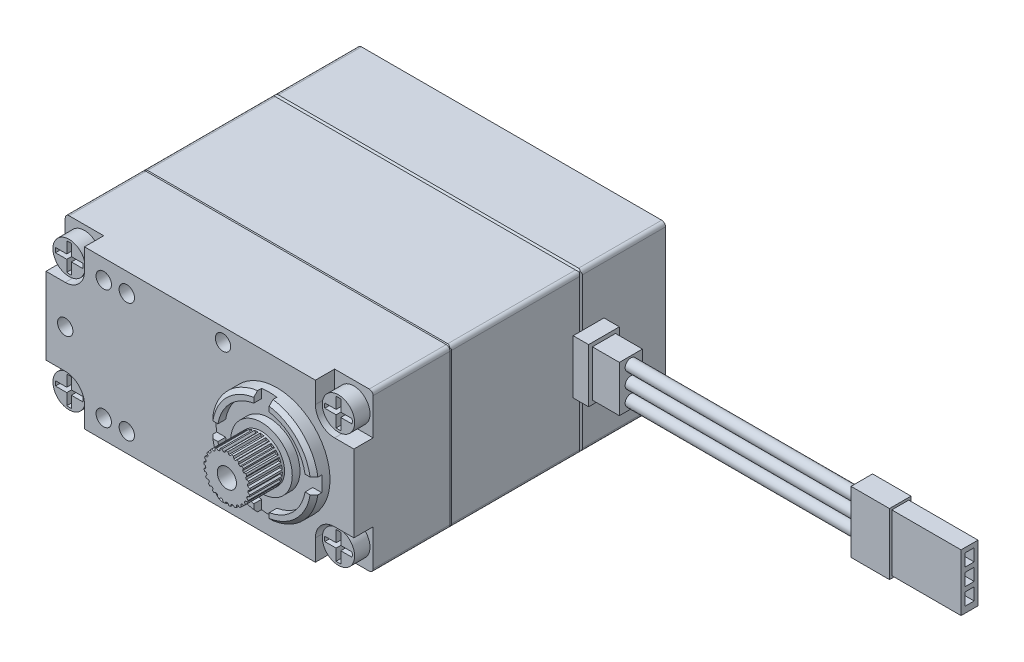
SolidWorks part; units mm, degrees
ref_plane "前视基准面" through (0, 0, 0) normal (0, 0, 1) x (1, 0, 0)
ref_plane "上视基准面" through (0, 0, 0) normal (0, 1, 0) x (1, 0, 0)
ref_plane "右视基准面" through (0, 0, 0) normal (1, 0, 0) x (0, 0, -1)
sketch "草图1" plane through (0, 0, 0) normal (0, 0, 1) x (1, 0, 0)
  line L1 (-20, 10.25) -> (20, 10.25)
  line L2 (-20, 10.25) -> (-20, -10.25)
  line L3 (-20, -10.25) -> (20, -10.25)
  line L4 (20, 10.25) -> (20, -10.25)
  dimension "D1" = 10.25
  dimension "D2" = 20.5
  dimension "D3" = 20
  dimension "D4" = 40
extrude "凸台-拉伸1" add sketch "草图1" along normal blind 11
chamfer "倒角1" distance 0.2 angle 45 4 edges at (0, 10.25, 11) (20, 0, 11) (0, -10.25, 11) (-20, 0, 11)
sketch "草图2" plane through (0, 0, 11) normal (0, 0, 1) x (1, 0, 0)
  line L0 (20, 10.25) -> (20, -10.25) construction
  line L1 (20, -10.25) -> (-20, -10.25) construction
  line L2 (-20, -10.25) -> (-20, 10.25) construction
  line L3 (-20, 10.25) -> (20, 10.25) construction
  line L4 (20, 10.25) -> (20, -10.25)
  line L5 (20, -10.25) -> (-20, -10.25)
  line L6 (-20, -10.25) -> (-20, 10.25)
  line L7 (-20, 10.25) -> (20, 10.25)
extrude "凸台-拉伸2" add sketch "草图2" along normal blind 17
chamfer "倒角4" distance 0.2 angle 45 4 edges at (-20, 0, 11) (0, 10.25, 11) (20, 0, 11) (0, -10.25, 11)
chamfer "倒角5" distance 0.2 angle 45 4 edges at (20, 0, 28) (0, -10.25, 28) (-20, 0, 28) (0, 10.25, 28)
sketch "草图3" plane through (0, 0, 28) normal (0, 0, 1) x (1, 0, 0)
  line L0 (20, 10.25) -> (20, -10.25) construction
  line L1 (20, -10.25) -> (-20, -10.25) construction
  line L2 (-20, -10.25) -> (-20, 10.25) construction
  line L3 (-20, 10.25) -> (20, 10.25) construction
  line L4 (20, 10.25) -> (20, -10.25)
  line L5 (20, -10.25) -> (-20, -10.25)
  line L6 (-20, -10.25) -> (-20, 10.25)
  line L7 (-20, 10.25) -> (20, 10.25)
extrude "凸台-拉伸3" add sketch "草图3" along normal blind 12.5
sketch "草图4" plane through (0, 0, 40.5) normal (0, 0, 1) x (1, 0, 0)
  line L0 (20, -10.25) -> (20, 10.25) construction
  circle A0 centre (10, 0) radius 6.9
  dimension "D1" = 10
  dimension "D2" = 13.8
extrude "凸台-拉伸4" add sketch "草图4" along normal blind 2
sketch "草图5" plane through (0, 0, 42.5) normal (0, 0, 1) x (1, 0, 0)
  circle A0 centre (10, 0) radius 3
  dimension "D1" = 6
extrude "凸台-拉伸5" add sketch "草图5" along normal blind 4.5
sketch "草图6" plane through (0, 0, 42.5) normal (0, 0, 1) x (1, 0, 0)
  circle A0 centre (10, 0) radius 4
  circle A1 centre (10, 0) radius 5.75
  dimension "D1" = 8
  dimension "D2" = 11.5
extrude "切除-拉伸1" cut sketch "草图6" against normal blind 1
sketch "草图7" plane through (0, 0, 41.5) normal (0, 0, 1) x (1, 0, 0)
  line L0 (11, 6.8272) -> (11, 5.6624)
  line L1 (3.1728, -1) -> (4.3376, -1)
  line L2 (3.1728, 1) -> (4.3376, 1)
  line L5 (9, 6.8272) -> (9, 5.6624)
  line L6 (16.8272, -1) -> (15.6624, -1)
  line L7 (16.8272, 1) -> (15.6624, 1)
  line L8 (9, -6.8272) -> (9, -5.6624)
  line L9 (11, -6.8272) -> (11, -5.6624)
  circle A0 centre (10, 0) radius 5.75 construction
  arc A1 (4.3376, 1) -> (4.3376, -1) centre (10, 0) ccw
  circle A2 centre (10, 0) radius 6.9 construction
  arc A3 (3.1728, 1) -> (3.1728, -1) centre (10, 0) ccw
  arc A6 (11, 5.6624) -> (9, 5.6624) centre (10, 0) ccw
  arc A7 (11, 6.8272) -> (9, 6.8272) centre (10, 0) ccw
  arc A8 (15.6624, -1) -> (15.6624, 1) centre (10, 0) ccw
  arc A9 (16.8272, -1) -> (16.8272, 1) centre (10, 0) ccw
  arc A10 (9, -5.6624) -> (11, -5.6624) centre (10, 0) ccw
  arc A11 (9, -6.8272) -> (11, -6.8272) centre (10, 0) ccw
  point P3 (0.7328, -1)
  point P4 (20.4054, -1)
  point P5 (0.7328, 1)
  point P6 (20.4054, 1)
  point P27 (10, 0)
  dimension "D1" = 4
extrude "切除-拉伸5" cut sketch "草图7" along normal blind 1
ref_plane "基准面1" through (0, 0, 27.7) normal (0, 0, 1) x (1, 0, 0)
sketch "草图11" plane through (0, 0, 47) normal (0, 0, 1) x (1, 0, 0)
  circle A0 centre (10, 0) radius 1.25
  dimension "D1" = 2.5
extrude "切除-拉伸7" cut sketch "草图11" against normal blind 6
sketch "草图12" plane through (0, 0, 47) normal (0, 0, 1) x (1, 0, 0)
  line L1 (9.76, 2.7395) -> (9.88, 2.9976)
  line L2 (10.24, 2.7395) -> (10.12, 2.9976)
  line L3 (10.9137, 2.5938) -> (10.8617, 2.8736)
  line L4 (10.4488, 2.7131) -> (10.6292, 2.9333)
  line L5 (11.5301, 2.285) -> (11.5493, 2.569)
  line L6 (11.1095, 2.5163) -> (11.3389, 2.6846)
  line L7 (12.0503, 1.8327) -> (12.1395, 2.103)
  line L8 (11.7004, 2.1613) -> (11.9645, 2.2673)
  line L9 (12.4416, 1.2653) -> (12.5953, 1.5049)
  line L10 (12.1844, 1.6705) -> (12.4667, 1.7075)
  line L11 (12.6796, 0.6183) -> (12.888, 0.8122)
  line L12 (12.5313, 1.0748) -> (12.8138, 1.0404)
  line L13 (12.7492, -0.0675) -> (12.9992, 0.0685)
  line L14 (12.719, 0.4115) -> (12.9841, 0.308)
  line L15 (12.646, -0.7491) -> (12.922, -0.6796)
  line L16 (12.736, -0.2776) -> (12.967, -0.4438)
  line L17 (12.3766, -1.3836) -> (12.6612, -1.3849)
  line L18 (12.581, -0.9493) -> (12.7634, -1.1677)
  line L19 (11.9578, -1.9312) -> (12.2332, -2.0032)
  line L20 (12.2638, -1.5613) -> (12.3862, -1.8183)
  line L21 (11.4161, -2.3574) -> (11.6649, -2.4956)
  line L22 (11.8044, -2.0752) -> (11.859, -2.3546)
  line L23 (10.7853, -2.6355) -> (10.9919, -2.8313)
  line L24 (11.2316, -2.4588) -> (11.2151, -2.7429)
  line L25 (10.1052, -2.748) -> (10.2566, -2.989)
  line L26 (10.5815, -2.6878) -> (10.4948, -2.9589)
  line L27 (9.4185, -2.6878) -> (9.5052, -2.9589)
  line L28 (9.8948, -2.748) -> (9.7434, -2.989)
  line L29 (8.7684, -2.4588) -> (8.7849, -2.7429)
  line L30 (9.2147, -2.6355) -> (9.0081, -2.8313)
  line L31 (8.1956, -2.0752) -> (8.141, -2.3546)
  line L32 (8.5839, -2.3574) -> (8.3351, -2.4956)
  line L33 (7.7362, -1.5613) -> (7.6138, -1.8183)
  line L34 (8.0422, -1.9312) -> (7.7668, -2.0032)
  line L35 (7.419, -0.9493) -> (7.2366, -1.1677)
  line L36 (7.6234, -1.3836) -> (7.3388, -1.3849)
  line L37 (7.264, -0.2776) -> (7.033, -0.4438)
  line L38 (7.354, -0.7491) -> (7.078, -0.6796)
  line L39 (7.281, 0.4115) -> (7.0159, 0.308)
  line L40 (7.2508, -0.0675) -> (7.0008, 0.0685)
  line L41 (7.4687, 1.0748) -> (7.1862, 1.0404)
  line L42 (7.3204, 0.6183) -> (7.112, 0.8122)
  line L43 (7.8156, 1.6705) -> (7.5333, 1.7075)
  line L44 (7.5584, 1.2653) -> (7.4047, 1.5049)
  line L45 (8.2996, 2.1613) -> (8.0355, 2.2673)
  line L46 (7.9497, 1.8327) -> (7.8605, 2.103)
  line L47 (8.8905, 2.5163) -> (8.6611, 2.6846)
  line L48 (8.4699, 2.285) -> (8.4507, 2.569)
  line L49 (9.5512, 2.7131) -> (9.3708, 2.9333)
  line L50 (9.0863, 2.5938) -> (9.1383, 2.8736)
  arc A0 (9.76, 2.7395) -> (9.5512, 2.7131) centre (10, 0) ccw
  arc A1 (9.0863, 2.5938) -> (8.8905, 2.5163) centre (10, 0) ccw
  circle A2 centre (10, 0) radius 3 construction
  arc A3 (9.88, 2.9976) -> (9.3708, 2.9333) centre (10, 0) ccw
  arc A4 (9.1383, 2.8736) -> (8.6611, 2.6846) centre (10, 0) ccw
  arc A5 (8.4699, 2.285) -> (8.2996, 2.1613) centre (10, 0) ccw
  arc A6 (8.4507, 2.569) -> (8.0355, 2.2673) centre (10, 0) ccw
  arc A7 (7.9497, 1.8327) -> (7.8156, 1.6705) centre (10, 0) ccw
  arc A8 (7.8605, 2.103) -> (7.5333, 1.7075) centre (10, 0) ccw
  arc A9 (7.5584, 1.2653) -> (7.4687, 1.0748) centre (10, 0) ccw
  arc A10 (7.4047, 1.5049) -> (7.1862, 1.0404) centre (10, 0) ccw
  arc A11 (7.3204, 0.6183) -> (7.281, 0.4115) centre (10, 0) ccw
  arc A12 (7.112, 0.8122) -> (7.0159, 0.308) centre (10, 0) ccw
  arc A13 (7.2508, -0.0675) -> (7.264, -0.2776) centre (10, 0) ccw
  arc A14 (7.0008, 0.0685) -> (7.033, -0.4438) centre (10, 0) ccw
  arc A15 (7.354, -0.7491) -> (7.419, -0.9493) centre (10, 0) ccw
  arc A16 (7.078, -0.6796) -> (7.2366, -1.1677) centre (10, 0) ccw
  arc A17 (7.3388, -1.3849) -> (7.6138, -1.8183) centre (10, 0) ccw
  arc A18 (7.6234, -1.3836) -> (7.7362, -1.5613) centre (10, 0) ccw
  arc A19 (8.0422, -1.9312) -> (8.1956, -2.0752) centre (10, 0) ccw
  arc A20 (7.7668, -2.0032) -> (8.141, -2.3546) centre (10, 0) ccw
  arc A21 (8.5839, -2.3574) -> (8.7684, -2.4588) centre (10, 0) ccw
  arc A22 (8.3351, -2.4956) -> (8.7849, -2.7429) centre (10, 0) ccw
  arc A23 (9.2147, -2.6355) -> (9.4185, -2.6878) centre (10, 0) ccw
  arc A24 (9.0081, -2.8313) -> (9.5052, -2.9589) centre (10, 0) ccw
  arc A25 (9.8948, -2.748) -> (10.1052, -2.748) centre (10, 0) ccw
  arc A26 (9.7434, -2.989) -> (10.2566, -2.989) centre (10, 0) ccw
  arc A27 (10.5815, -2.6878) -> (10.7853, -2.6355) centre (10, 0) ccw
  arc A28 (10.4948, -2.9589) -> (10.9919, -2.8313) centre (10, 0) ccw
  arc A29 (11.2316, -2.4588) -> (11.4161, -2.3574) centre (10, 0) ccw
  arc A30 (11.2151, -2.7429) -> (11.6649, -2.4956) centre (10, 0) ccw
  arc A31 (11.8044, -2.0752) -> (11.9578, -1.9312) centre (10, 0) ccw
  arc A32 (11.859, -2.3546) -> (12.2332, -2.0032) centre (10, 0) ccw
  arc A33 (12.3862, -1.8183) -> (12.6612, -1.3849) centre (10, 0) ccw
  arc A34 (12.2638, -1.5613) -> (12.3766, -1.3836) centre (10, 0) ccw
  arc A35 (12.7634, -1.1677) -> (12.922, -0.6796) centre (10, 0) ccw
  arc A36 (12.581, -0.9493) -> (12.646, -0.7491) centre (10, 0) ccw
  arc A37 (12.967, -0.4438) -> (12.9992, 0.0685) centre (10, 0) ccw
  arc A38 (12.736, -0.2776) -> (12.7492, -0.0675) centre (10, 0) ccw
  arc A39 (12.9841, 0.308) -> (12.888, 0.8122) centre (10, 0) ccw
  arc A40 (12.719, 0.4115) -> (12.6796, 0.6183) centre (10, 0) ccw
  arc A41 (12.5313, 1.0748) -> (12.4416, 1.2653) centre (10, 0) ccw
  arc A42 (12.8138, 1.0404) -> (12.5953, 1.5049) centre (10, 0) ccw
  arc A43 (12.1844, 1.6705) -> (12.0503, 1.8327) centre (10, 0) ccw
  arc A44 (12.4667, 1.7075) -> (12.1395, 2.103) centre (10, 0) ccw
  arc A45 (11.7004, 2.1613) -> (11.5301, 2.285) centre (10, 0) ccw
  arc A46 (11.9645, 2.2673) -> (11.5493, 2.569) centre (10, 0) ccw
  arc A47 (11.1095, 2.5163) -> (10.9137, 2.5938) centre (10, 0) ccw
  arc A48 (11.3389, 2.6846) -> (10.8617, 2.8736) centre (10, 0) ccw
  arc A49 (10.4488, 2.7131) -> (10.24, 2.7395) centre (10, 0) ccw
  arc A50 (10.6292, 2.9333) -> (10.12, 2.9976) centre (10, 0) ccw
  point P111 (10, 0)
  dimension "D1" = 5.5
  dimension "D4" = 25
extrude "切除-拉伸8" cut sketch "草图12" against normal blind 4.2
sketch "草图17" plane through (20, 0, 0) normal (1, 0, 0) x (0, 0, -1)
  line L2 (-12, 3.5) -> (-8, 3.5)
  line L3 (-12, 3.5) -> (-12, -3.5)
  line L4 (-12, -3.5) -> (-8, -3.5)
  line L5 (-8, 3.5) -> (-8, -3.5)
  dimension "D2" = 7
  dimension "D3" = 3.5
  dimension "D4" = 4
extrude "凸台-拉伸8" add sketch "草图17" along normal blind 2
sketch "草图18" plane through (22, 0, 0) normal (1, 0, 0) x (0, 0, -1)
  line L8 (-11.5, 3) -> (-11.5, -3)
  line L9 (-11.5, -3) -> (-8.5, -3)
  line L10 (-8.5, -3) -> (-8.5, 3)
  line L11 (-8.5, 3) -> (-11.5, 3)
  line L12 (-11.5, 3) -> (-11.5, -3)
  line L13 (-11.5, -3) -> (-8.5, -3)
  line L14 (-8.5, -3) -> (-8.5, 3)
  line L15 (-8.5, 3) -> (-11.5, 3)
  dimension "D1" = 0.5
extrude "凸台-拉伸9" add sketch "草图18" along normal blind 3.5
sketch "草图19" plane through (25.5, 0, 0) normal (1, 0, 0) x (0, 0, -1)
  line L0 (-8.5, -3) -> (-8.5, 3) construction
  line L1 (-8.5, -3) -> (-8.5, 3) construction
  line L2 (-8.5, 3) -> (-11.5, 3) construction
  circle A0 centre (-10, 0) radius 0.75
  circle A1 centre (-10, 2) radius 0.75
  circle A2 centre (-10, -2) radius 0.75
  dimension "D1" = 1.5
  dimension "D2" = 1.5
  dimension "D3" = 1.5
  dimension "D4" = 1.5
  dimension "D5" = 1.5
  dimension "D6" = 1.5
  dimension "D7" = 1
  dimension "D8" = 2
  dimension "D9" = 2
extrude "凸台-拉伸10" add sketch "草图19" along normal blind 30
sketch "草图20" plane through (55.5, 0, 0) normal (1, 0, 0) x (0, 0, -1)
  line L1 (-11.4, 4) -> (-8.6, 4)
  line L2 (-11.4, 4) -> (-11.4, -4)
  line L3 (-11.4, -4) -> (-8.6, -4)
  line L4 (-8.6, 4) -> (-8.6, -4)
  circle A0 centre (-10, 2) radius 0.75 construction
  dimension "D1" = 8
  dimension "D2" = 2.8
  dimension "D3" = 1.4
  dimension "D4" = 4
extrude "凸台-拉伸11" add sketch "草图20" along normal blind 5
sketch "草图21" plane through (60.5, 0, 0) normal (1, 0, 0) x (0, 0, -1)
  line L5 (-10.59, 3.1) -> (-9.4, 3.1)
  line L6 (-10.59, 3.1) -> (-10.59, 1.5)
  line L7 (-10.59, 1.5) -> (-9.4, 1.5)
  line L8 (-11.1, 3.7) -> (-11.1, -3.7)
  line L9 (-11.1, -3.7) -> (-8.9, -3.7)
  line L10 (-8.9, -3.7) -> (-8.9, 3.7)
  line L11 (-8.9, 3.7) -> (-11.1, 3.7)
  line L12 (-11.1, 3.7) -> (-11.1, -3.7)
  line L13 (-11.1, -3.7) -> (-8.9, -3.7)
  line L14 (-8.9, -3.7) -> (-8.9, 3.7)
  line L15 (-8.9, 3.7) -> (-11.1, 3.7)
  line L16 (-9.4, 3.1) -> (-9.4, 1.5)
  line L17 (-10.59, 0.9) -> (-9.4, 0.9)
  line L18 (-10.59, 0.9) -> (-10.59, -0.7)
  line L19 (-10.59, -0.7) -> (-9.4, -0.7)
  line L20 (-9.4, 0.9) -> (-9.4, -0.7)
  line L21 (-10.59, -1.3) -> (-9.4, -1.3)
  line L22 (-10.59, -1.3) -> (-10.59, -2.9)
  line L23 (-10.59, -2.9) -> (-9.4, -2.9)
  line L24 (-9.4, -1.3) -> (-9.4, -2.9)
  dimension "D2" = 1.6
  dimension "D3" = 1.6
  dimension "D4" = 1.6
  dimension "D5" = 0.5
  dimension "D6" = 0.5
  dimension "D7" = 0.5
  dimension "D8" = 0.6
  dimension "D9" = 0.6
  dimension "D10" = 0.6
  dimension "D1" = 0.3
extrude "凸台-拉伸12" add sketch "草图21" along normal blind 9
chamfer "倒角6" distance 0.5 angle 45 4 edges at (5.121, 4.879, 42.5) (14.879, 4.879, 42.5) (14.879, -4.879, 42.5) (5.121, -4.879, 42.5)
fillet "圆角6" radius 0.5 4 edges at (20, 10.25, 34.25) (20, -10.25, 34.25) (-20, 10.25, 34.25) (-20, -10.25, 34.25)
fillet "圆角7" radius 0.5 4 edges at (20, -10.25, 19.5) (20, 10.25, 19.5) (-20, 10.25, 19.5) (-20, -10.25, 19.5)
fillet "圆角8" radius 0.5 4 edges at (20, 10.25, 5.4) (-20, 10.25, 5.4) (-20, -10.25, 5.4) (20, -10.25, 5.4)
sketch "草图26" plane through (0, 0, 0) normal (0, 0, -1) x (-1, 0, 0)
  circle A0 centre (-10, 0) radius 6.25
  dimension "D1" = 12.5
extrude "凸台-拉伸15" add sketch "草图26" along normal blind 1.5
sketch "草图27" plane through (0, 0, -1.5) normal (0, 0, -1) x (-1, 0, 0)
  circle A0 centre (-10, 0) radius 3.45
  dimension "D1" = 6.9
extrude "凸台-拉伸16" add sketch "草图27" along normal blind 4.3
sketch "草图28" plane through (0, 0, -5.8) normal (0, 0, -1) x (-1, 0, 0)
  circle A0 centre (-10, 0) radius 3
  circle A1 centre (-10, 0) radius 3.45 construction
  circle A2 centre (-10, 0) radius 3.45
  dimension "D1" = 6
extrude "切除-拉伸15" cut sketch "草图28" against normal blind 4.2
sketch "草图29" plane through (0, 0, -5.8) normal (0, 0, -1) x (-1, 0, 0)
  circle A0 centre (-10, 0) radius 1.25
  dimension "D1" = 2.5
extrude "切除-拉伸16" cut sketch "草图29" against normal blind 5
sketch "草图30" plane through (0, 0, 40.5) normal (0, 0, 1) x (1, 0, 0)
  line L0 (20, -9.75) -> (20, 9.75) construction
  line L1 (-20, 9.75) -> (-20, -9.75) construction
  line L2 (19.5, 10.25) -> (-19.5, 10.25) construction
  circle A0 centre (3, 8.5) radius 1
  circle A1 centre (3, -8.5) radius 1
  circle A2 centre (-17.5, 0) radius 1
  circle A3 centre (-9.5, 7.75) radius 1
  circle A4 centre (-12.5, 7.75) radius 1
  circle A5 centre (-12.5, -7.75) radius 1
  circle A6 centre (-9.5, -7.75) radius 1
  dimension "D1" = 2
  dimension "D2" = 2
  dimension "D3" = 8.5
  dimension "D4" = 8.5
  dimension "D5" = 17
  dimension "D6" = 17
  dimension "D7" = 2
  dimension "D8" = 2.5
  dimension "D9" = 2.5
  dimension "D10" = 2
  dimension "D11" = 2
  dimension "D12" = 3
  dimension "D13" = 5
  dimension "D14" = 5
  dimension "D15" = 3
extrude "切除-拉伸17" cut sketch "草图30" against normal blind 3
sketch "草图32" plane through (0, 0, 40.5) normal (0, 0, 1) x (1, 0, 0)
  line L0 (-15, 7.5) -> (-15, 10.25)
  line L1 (-17.5, 5) -> (-20, 5)
  line L2 (19.5, 10.25) -> (-19.5, 10.25) construction
  line L3 (-15, 10.25) -> (-19.5, 10.25)
  line L4 (-20, 9.75) -> (-20, -9.75) construction
  line L5 (-20, 9.75) -> (-20, 5)
  line L8 (-20, -9.75) -> (-20, -5)
  line L9 (-15, -10.25) -> (-19.5, -10.25)
  line L10 (-17.5, -5) -> (-20, -5)
  line L11 (-15, -7.5) -> (-15, -10.25)
  line L12 (20, 9.75) -> (20, 5)
  line L13 (15, 10.25) -> (19.5, 10.25)
  line L14 (17.5, 5) -> (20, 5)
  line L15 (15, 7.5) -> (15, 10.25)
  line L16 (15, -7.5) -> (15, -10.25)
  line L17 (17.5, -5) -> (20, -5)
  line L18 (15, -10.25) -> (19.5, -10.25)
  line L19 (20, -9.75) -> (20, -5)
  arc A0 (-17.5, 5) -> (-15, 7.5) centre (-17.5, 7.5) ccw
  arc A1 (-19.5, 10.25) -> (-20, 9.75) centre (-19.5, 9.75) ccw construction
  arc A2 (-19.5, 10.25) -> (-20, 9.75) centre (-19.5, 9.75) ccw
  arc A3 (-19.5, -10.25) -> (-20, -9.75) centre (-19.5, -9.75) cw
  arc A4 (-17.5, -5) -> (-15, -7.5) centre (-17.5, -7.5) cw
  arc A5 (19.5, 10.25) -> (20, 9.75) centre (19.5, 9.75) cw
  arc A6 (17.5, 5) -> (15, 7.5) centre (17.5, 7.5) cw
  arc A7 (17.5, -5) -> (15, -7.5) centre (17.5, -7.5) ccw
  arc A8 (19.5, -10.25) -> (20, -9.75) centre (19.5, -9.75) ccw
  dimension "D1" = 5
extrude "切除-拉伸18" cut sketch "草图32" against normal blind 2.5
sketch "草图33" plane through (0, 0, 38) normal (0, 0, 1) x (1, 0, 0)
  line L2 (-19.2748, 7.2) -> (-17.8, 7.2)
  line L3 (-17.8, 9.2748) -> (-17.8, 7.8)
  line L4 (-19.2748, 7.8) -> (-17.8, 7.8)
  line L5 (-17.2, 9.2748) -> (-17.2, 7.8)
  line L6 (-17.2, 7.2) -> (-17.2, 5.7252)
  line L7 (-17.2, 7.8) -> (-15.7252, 7.8)
  line L9 (-17.8, 7.2) -> (-17.8, 5.7252)
  line L10 (-17.2, -7.2) -> (-15.7252, -7.2)
  line L11 (-17.8, -7.2) -> (-17.8, -5.7252)
  line L12 (-17.2, -7.8) -> (-15.7252, -7.8)
  line L13 (-17.2, 7.2) -> (-15.7252, 7.2)
  line L14 (-17.2, -7.2) -> (-17.2, -5.7252)
  line L15 (-17.2, -9.2748) -> (-17.2, -7.8)
  line L16 (-19.2748, -7.8) -> (-17.8, -7.8)
  line L17 (-17.8, -9.2748) -> (-17.8, -7.8)
  line L18 (-19.2748, -7.2) -> (-17.8, -7.2)
  line L19 (19.2748, -7.2) -> (17.8, -7.2)
  line L20 (17.8, -9.2748) -> (17.8, -7.8)
  line L21 (19.2748, -7.8) -> (17.8, -7.8)
  line L22 (17.2, -9.2748) -> (17.2, -7.8)
  line L23 (17.2, -7.2) -> (17.2, -5.7252)
  line L24 (17.2, -7.8) -> (15.7252, -7.8)
  line L25 (17.8, -7.2) -> (17.8, -5.7252)
  line L26 (17.2, -7.2) -> (15.7252, -7.2)
  line L27 (17.2, 7.2) -> (15.7252, 7.2)
  line L28 (17.8, 7.2) -> (17.8, 5.7252)
  line L29 (17.2, 7.8) -> (15.7252, 7.8)
  line L30 (17.2, 7.2) -> (17.2, 5.7252)
  line L31 (17.2, 9.2748) -> (17.2, 7.8)
  line L32 (19.2748, 7.8) -> (17.8, 7.8)
  line L33 (17.8, 9.2748) -> (17.8, 7.8)
  line L34 (19.2748, 7.2) -> (17.8, 7.2)
  circle A0 centre (-17.5, 7.5) radius 2.1
  arc A1 (-17.2, 9.2748) -> (-17.8, 9.2748) centre (-17.5, 7.5) ccw
  arc A2 (-15.7252, 7.2) -> (-15.7252, 7.8) centre (-17.5, 7.5) ccw
  arc A3 (-17.8, 5.7252) -> (-17.2, 5.7252) centre (-17.5, 7.5) ccw
  arc A4 (-19.2748, 7.8) -> (-19.2748, 7.2) centre (-17.5, 7.5) ccw
  arc A5 (-19.2748, -7.8) -> (-19.2748, -7.2) centre (-17.5, -7.5) cw
  arc A6 (-17.8, -5.7252) -> (-17.2, -5.7252) centre (-17.5, -7.5) cw
  arc A7 (-15.7252, -7.2) -> (-15.7252, -7.8) centre (-17.5, -7.5) cw
  arc A8 (-17.2, -9.2748) -> (-17.8, -9.2748) centre (-17.5, -7.5) cw
  circle A9 centre (-17.5, -7.5) radius 2.1
  circle A10 centre (17.5, -7.5) radius 2.1
  arc A11 (17.2, -9.2748) -> (17.8, -9.2748) centre (17.5, -7.5) ccw
  arc A12 (15.7252, -7.2) -> (15.7252, -7.8) centre (17.5, -7.5) ccw
  arc A13 (17.8, -5.7252) -> (17.2, -5.7252) centre (17.5, -7.5) ccw
  arc A14 (19.2748, -7.8) -> (19.2748, -7.2) centre (17.5, -7.5) ccw
  arc A15 (19.2748, 7.8) -> (19.2748, 7.2) centre (17.5, 7.5) cw
  arc A16 (17.8, 5.7252) -> (17.2, 5.7252) centre (17.5, 7.5) cw
  arc A17 (15.7252, 7.2) -> (15.7252, 7.8) centre (17.5, 7.5) cw
  arc A18 (17.2, 9.2748) -> (17.8, 9.2748) centre (17.5, 7.5) cw
  circle A19 centre (17.5, 7.5) radius 2.1
  point P6 (-19.3, 7.5)
  point P7 (-15.5365, 7.5)
  point P8 (-19.3, 7.2)
  point P9 (-15.5365, 7.2)
  point P10 (-17.8, 9.3)
  point P11 (-17.8, 5.5747)
  point P12 (-19.3, 7.8)
  point P13 (-15.5365, 7.8)
  point P14 (-17.2, 9.3)
  point P15 (-17.2, 5.5747)
  dimension "D1" = 4.2
  dimension "D2" = 3.6
extrude "凸台-拉伸18" add sketch "草图33" along normal blind 2
sketch "草图34" plane through (0, 0, 0) normal (0, 0, -1) x (-1, 0, 0)
  line L0 (-19.5, 10.25) -> (19.5, 10.25) construction
  line L1 (-20, -9.75) -> (-20, 9.75) construction
  line L3 (20, 9.75) -> (20, -9.75) construction
  circle A0 centre (-17.2, 8.25) radius 1
  circle A1 centre (-14.2, 8.25) radius 1
  circle A2 centre (0, 8.25) radius 1
  circle A3 centre (17.2, 8.25) radius 1
  circle A4 centre (17.2, -8.25) radius 1
  circle A5 centre (0, -8.25) radius 1
  circle A6 centre (-14.2, -8.25) radius 1
  circle A7 centre (-17.2, -8.25) radius 1
  dimension "D1" = 2
  dimension "D2" = 2
  dimension "D3" = 2
  dimension "D4" = 2
  dimension "D5" = 3
  dimension "D6" = 2.8
  dimension "D7" = 2
  dimension "D8" = 2
  dimension "D9" = 2.8
extrude "切除-拉伸19" cut sketch "草图34" against normal blind 2.5
